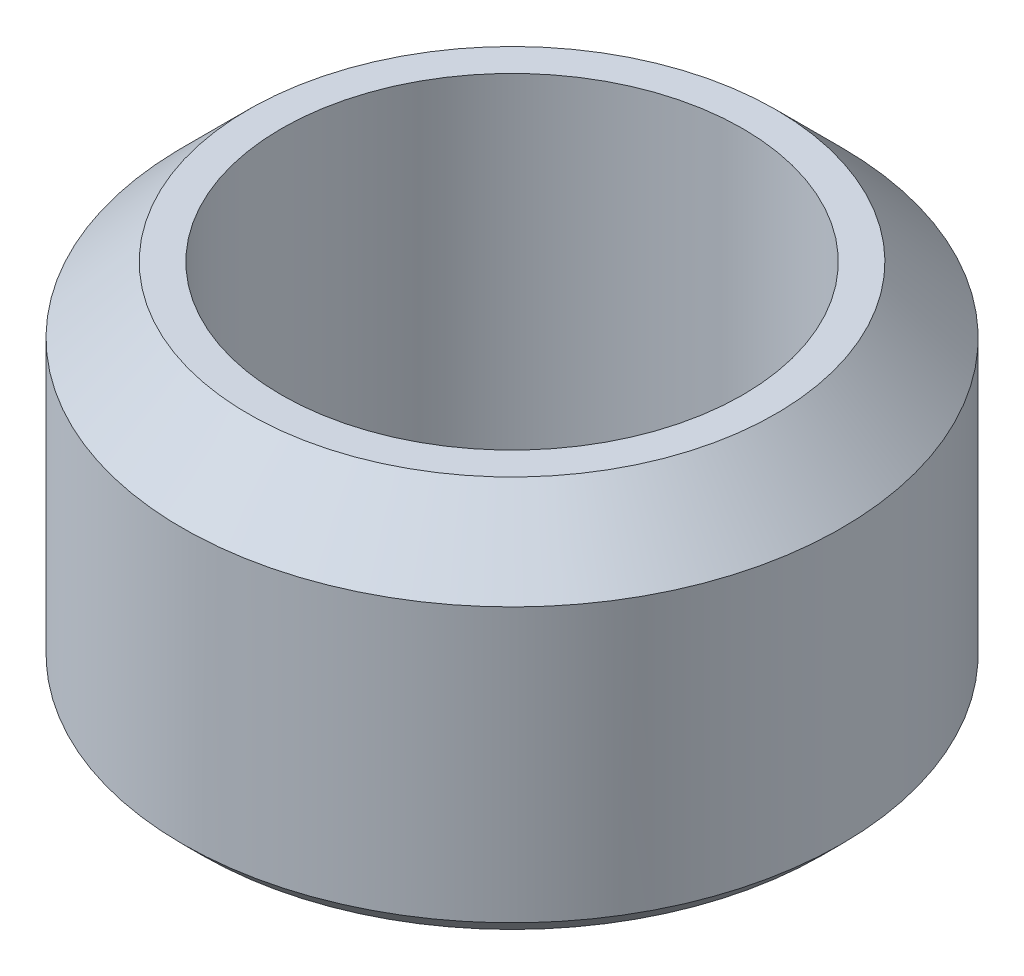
SolidWorks part; units mm, degrees
ref_plane "Plan de face" through (0, 0, 0) normal (0, 0, 1) x (1, 0, 0)
ref_plane "Plan de dessus" through (0, 0, 0) normal (0, 1, 0) x (1, 0, 0)
ref_plane "Plan de droite" through (0, 0, 0) normal (1, 0, 0) x (0, 0, -1)
sketch "Esquisse1" plane through (0, 0, 0) normal (0, 1, 0) x (1, 0, 0)
  circle A0 centre (0, 0) radius 50
  dimension "D1" = 100
extrude "Extrusion1" add sketch "Esquisse1" along normal blind 54.5
chamfer "Chanfrein1" distance 10 angle 45 1 edges at (0, 54.5, 50)
chamfer "Chanfrein2" distance 3 angle 45 1 edges at (0, 0, 50)
sketch "Esquisse2" plane through (0, 54.5, 0) normal (0, 1, 0) x (-1, 0, 0)
  circle A0 centre (0, 0) radius 35
  dimension "D1" = 70
extrude "Enlèv. mat.-Extru.1" cut sketch "Esquisse2" against normal up to next
